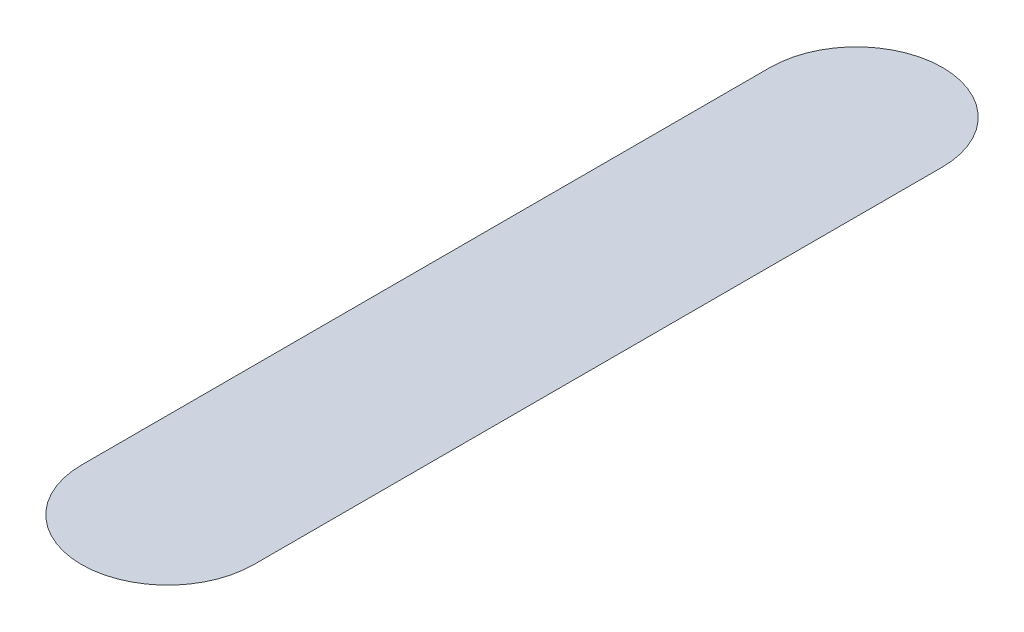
SolidWorks part; units mm, degrees
ref_plane "Plane1" through (0, 0, 0) normal (0, 0, 1) x (1, 0, 0)
ref_plane "Plane2" through (0, 0, 0) normal (0, 1, 0) x (1, 0, 0)
ref_plane "Plane3" through (0, 0, 0) normal (1, 0, 0) x (0, 0, -1)
sketch "Sketch1" plane through (0, 0, 0) normal (0, 0, 1) x (1, 0, 0)
  line L0 (-25, 5) -> (25, 5)
  line L1 (-25, 5) -> (-25, 0)
  line L2 (25, 0) -> (-25, 0)
  line L3 (25, 0) -> (25, 5)
  line L4 (0, 5) -> (0, 0) construction
  line L5 (50, 0) -> (-50, 0) construction
  dimension "D1" = 50
  dimension "D2" = 5
extrude "Base-Extrude" add sketch "Sketch1" along normal mid plane 203.2
sketch "Sketch10" plane through (0, 0, 0) normal (0, 1, 0) x (-1, 0, 0)
  line L4 (1.143, 8.382) -> (1.143, -8.382) construction
  line L5 (0, 50) -> (0, -50) construction
  line L6 (-1.143, 8.382) -> (-1.143, -8.382) construction
  line L8 (-1.143, 0) -> (1.143, 0) construction
  arc A0 (1.143, -8.382) -> (-1.143, -8.382) centre (0, -8.382) cw construction
  arc A1 (-1.143, 8.382) -> (1.143, 8.382) centre (0, 8.382) cw construction
  dimension "D1" = 2.286
  dimension "Rib Length" = 19.05
ref_plane "Plane4" through (0, 0, -8.382) normal (0, 0, 1) x (1, 0, 0)
ref_plane "Plane5" through (0, 0, 8.382) normal (0, 0, 1) x (1, 0, 0)
sketch "Sketch2" plane through (0, 0, -8.382) normal (0, 0, 1) x (1, 0, 0)
  line L0 (25, 0) -> (-25, 0) construction
  line L1 (0, -50) -> (0, 50) construction
  line L2 (1.143, 0) -> (-1.143, 0)
  arc A0 (-1.143, 0) -> (1.143, 0) centre (0, 0.1349) ccw
  dimension "D1" = 1.016
extrude "Boss-Extrude1" add sketch "Sketch2" along normal up to surface (16.764 mm away)
sketch "Sketch7" plane through (0, 0, 8.382) normal (0, 0, 1) x (1, 0, 0)
  line L1 (0, 0) -> (0, -1.016)
  line L2 (1.143, 0) -> (-1.143, 0)
  line L3 (0, 0) -> (-1.143, 0)
  arc A1 (-1.143, 0) -> (1.143, 0) centre (0, 0.1349) ccw
  arc A2 (-1.143, 0) -> (0, -1.016) centre (0, 0.1349) ccw
  dimension "D1" = 0
revolve "Boss-Revolve3" add sketch "Sketch7" angle 180 about L1
sketch "Sketch9" plane through (0, 0, -8.382) normal (0, 0, 1) x (1, 0, 0)
  line L1 (0, 0) -> (0, -1.016)
  line L2 (0, 0) -> (0, -1.016) construction
  line L3 (0, 0) -> (-1.143, 0)
  line L4 (0, 0) -> (-1.143, 0) construction
  arc A2 (-1.143, 0) -> (0, -1.016) centre (0, 0.1349) ccw
revolve "Boss-Revolve4" add sketch "Sketch9" angle 180 about L1
fillet "Fillet3" radius 1.524 4 edges at (-1.143, 0, 0) (1.143, 0, 0) (0, 0, 9.525) (0, 0, -9.525)
sketch "Sketch3" plane through (-25, 0, 0) normal (-1, 0, 0) x (0, 0, 1)
  line L4 (-101.6, 0) -> (101.6, 0)
  line L5 (101.6, 0) -> (101.6, 5)
  line L6 (101.6, 5) -> (-101.6, 5)
  line L7 (-101.6, 5) -> (-101.6, 0)
  line L8 (-101.6, 0) -> (101.6, 0)
  line L9 (101.6, 0) -> (101.6, 5)
  line L10 (101.6, 5) -> (-101.6, 5)
  line L11 (-101.6, 5) -> (-101.6, 0)
  dimension "D1" = 0
extrude "Cut-Extrude1" cut sketch "Sketch3" against normal through all
sketch "Orientation Sketch" plane through (0, 0, 0) normal (0, 1, 0) x (-1, 0, 0)
  line L2 (2.0984, -8.382) -> (2.0984, 8.382)
  line L3 (2.0984, -8.382) -> (2.0984, 8.382)
  line L4 (-2.0984, 8.382) -> (-2.0984, -8.382)
  line L5 (-2.0984, 8.382) -> (-2.0984, -8.382)
  arc A2 (-2.0984, -8.382) -> (2.0984, -8.382) centre (0, -8.382) ccw
  arc A3 (-2.0984, -8.382) -> (2.0984, -8.382) centre (0, -8.382) ccw
  arc A4 (2.0984, 8.382) -> (-2.0984, 8.382) centre (0, 8.382) ccw
  arc A5 (2.0984, 8.382) -> (-2.0984, 8.382) centre (0, 8.382) ccw
  dimension "D1" = 0
sketch "Orientation Sketch" plane through (0, 0, 0) normal (0, 1, 0) x (1, 0, 0)
  line L0 (-2.0984, 8.382) -> (-2.0984, -8.382) construction
  line L1 (2.0984, -8.382) -> (2.0984, 8.382) construction
  line L4 (-2.0984, 8.382) -> (-2.0984, -8.382)
  line L5 (2.0984, -8.382) -> (2.0984, 8.382)
  arc A0 (-2.0984, -8.382) -> (2.0984, -8.382) centre (0, -8.382) ccw construction
  arc A1 (2.0984, 8.382) -> (-2.0984, 8.382) centre (0, 8.382) ccw construction
  arc A4 (-2.0984, -8.382) -> (2.0984, -8.382) centre (0, -8.382) ccw
  arc A5 (2.0984, 8.382) -> (-2.0984, 8.382) centre (0, 8.382) ccw
other "FormTool1"
